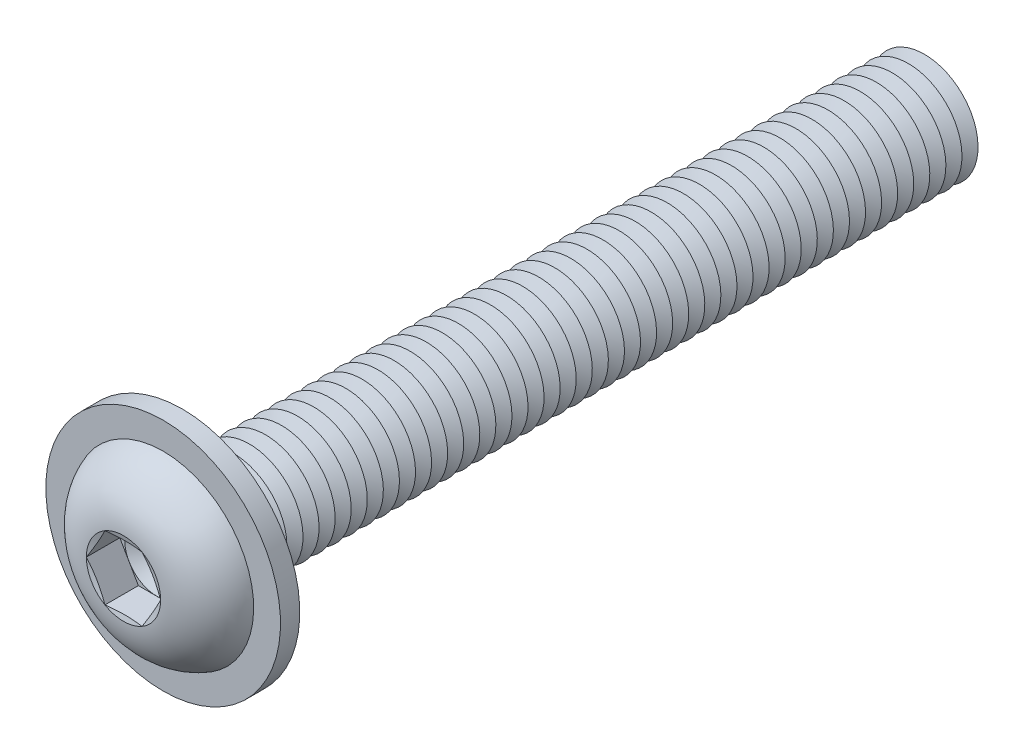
SolidWorks part; units mm, degrees
ref_plane "Front Plane" through (0, 0, 0) normal (0, 0, 1) x (1, 0, 0)
ref_plane "Top Plane" through (0, 0, 0) normal (0, 1, 0) x (1, 0, 0)
ref_plane "Right Plane" through (0, 0, 0) normal (1, 0, 0) x (0, 0, -1)
sketch "Sketch1" plane through (0, 0, 0) normal (1, 0, 0) x (0, 0, -1)
  line L0 (0, 5) -> (0, 8.75)
  line L3 (0, 5) -> (70, 5)
  line L4 (70, 5) -> (70, 0)
  line L5 (70, 0) -> (-5.5, 0) construction
  line L6 (-5.5, 0) -> (70, 0)
  line L7 (-5.5, 3.4641) -> (-5.5, 1.732) construction
  line L8 (-5.5, 1.732) -> (-5.5, 0)
  line L9 (-5.5, 3.4641) -> (-5.0359, 1.732)
  line L10 (-5.0359, 1.732) -> (-5.5, 1.732)
  line L11 (70, 0) -> (22.7481, 0) construction
  line L12 (0, 8.75) -> (-5.5, 8.75) construction
  arc A1 (0, 8.75) -> (-5.5, 3.4641) centre (0, 3.2457) ccw
  point P8 (70, 2.5)
  dimension "D1" = 17.5
  dimension "D2" = 10
  dimension "D3" = 5.5
  dimension "D4" = 6.9282
  dimension "D5" = 70
  dimension "D6" = 15
revolve "Revolve1" add sketch "Sketch1" angle 360 about L5
fillet "Fillet1" radius 0.75 1 edges at (0, 5, 0)
sketch "Sketch2" plane through (0, 0, 0) normal (1, 0, 0) x (0, 0, -1)
  line L0 (69.25, 5) -> (70.75, 5)
  line L1 (70, 5) -> (0.75, 5) construction
  line L2 (70.75, 5) -> (70, 3.701)
  line L3 (70, -5) -> (70, 5) construction
  line L4 (70, 3.701) -> (69.25, 5)
  dimension "D1" = 1.5
revolve "Cut-Revolve1" cut sketch "Sketch2" angle 360 about axis through (0, 0, -70) along (0, 0, -1)
pattern_linear "LPattern1" count 46 spacing 1.5 along (0, 0, 1) of "Cut-Revolve1"
sketch "Sketch3" plane through (0, 0, 5.5) normal (0, 0, 1) x (1, 0, 0)
  line L7 (1.732, 3) -> (-1.7321, 3)
  line L8 (-1.7321, 3) -> (-3.4641, 0)
  line L9 (-3.4641, 0) -> (-1.732, -3)
  line L10 (-1.732, -3) -> (1.732, -3)
  line L11 (1.732, -3) -> (3.4641, 0)
  line L12 (3.4641, 0) -> (1.732, 3)
  circle A0 centre (0, 0) radius 3 construction
  circle A3 centre (0, 0) radius 3.4641 construction
extrude "Cut-Extrude1" cut sketch "Sketch3" against normal blind 3.12
sketch "Sketch4" plane through (0, 0, 2.38) normal (0, 0, 1) x (1, 0, 0)
  line L1 (1.732, 3) -> (-1.7321, 3) construction
  circle A0 centre (0, 0) radius 3
extrude "Cut-Extrude2" cut sketch "Sketch4" against normal through all draft 60
sketch "Sketch5" plane through (0, 0, 0) normal (0, 0, -1) x (-1, 0, 0)
  circle A0 centre (0, 0) radius 10.95
  circle A1 centre (0, 0) radius 5.75
  circle A2 centre (0, 0) radius 5.75 construction
  dimension "D1" = 21.9
extrude "Boss-Extrude1" add sketch "Sketch5" against normal blind 1.8
